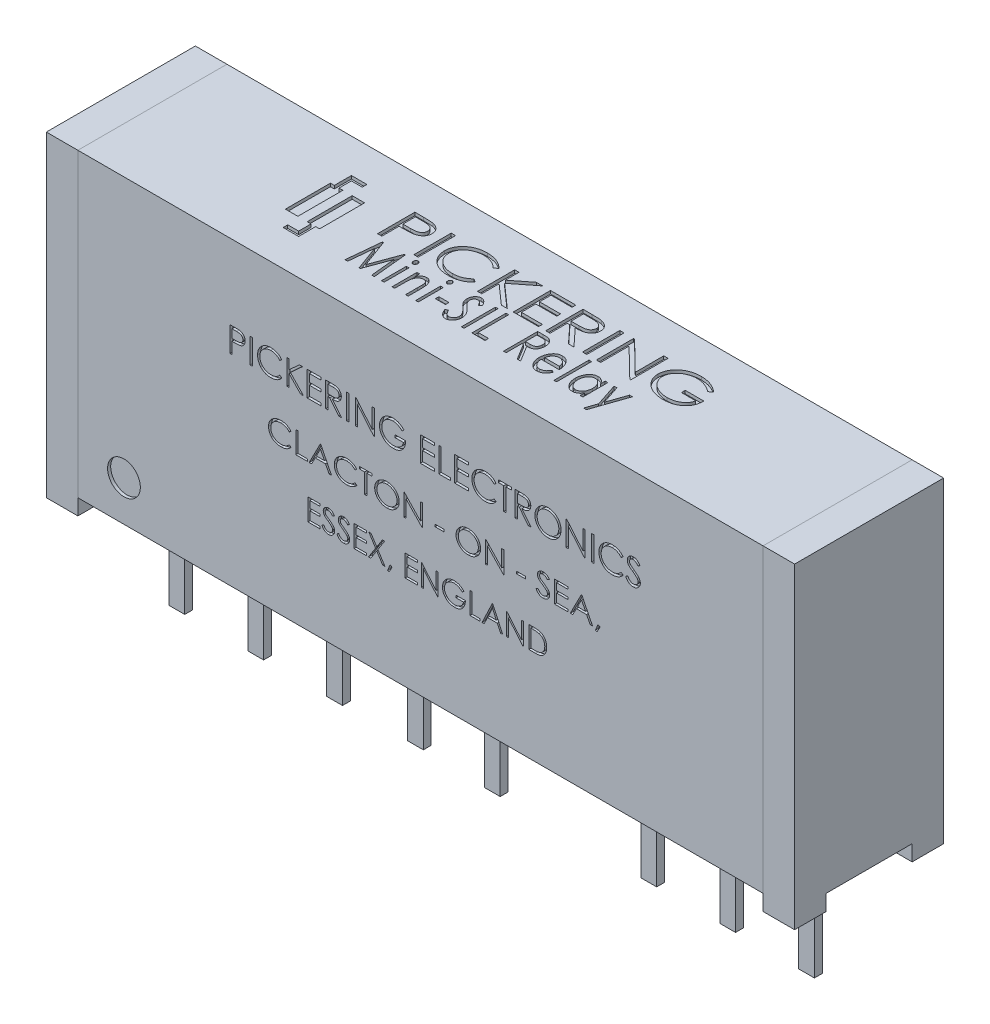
SolidWorks part; units mm, degrees
ref_plane "Front Plane" through (0, 0, 0) normal (0, 0, 1) x (1, 0, 0)
ref_plane "Top Plane" through (0, 0, 0) normal (0, 1, 0) x (1, 0, 0)
ref_plane "Right Plane" through (0, 0, 0) normal (1, 0, 0) x (0, 0, -1)
sketch "Sketch1" plane through (0, 0, 0) normal (0, 1, 0) x (1, 0, 0)
  line L1 (11.034, -2.4) -> (-11.034, -2.4)
  line L2 (11.034, -2.4) -> (11.034, 2.4)
  line L3 (11.034, 2.4) -> (-11.034, 2.4)
  line L4 (-11.034, -2.4) -> (-11.034, 2.4)
  line L5 (11.034, -2.4) -> (-11.034, 2.4) construction
  line L6 (11.034, 2.4) -> (-11.034, -2.4) construction
  point P0 (0, 0)
  dimension "D1" = 4.8
  dimension "D2" = 22.068
extrude "main box" add sketch "Sketch1" along normal blind 9.692
sketch "Sketch2" plane through (-11.034, 0, 0) normal (-1, 0, 0) x (0, 0, 1)
  line L0 (-2.4, 9.692) -> (2.4, 9.692)
  line L1 (2.4, 9.692) -> (2.4, -0.508)
  line L2 (2.4, -0.508) -> (-2.4, -0.508)
  line L3 (-2.4, -0.508) -> (-2.4, 9.692)
  dimension "D1" = 10.2
extrude "end section plus feet" add sketch "Sketch2" along normal blind 1.016 separate body
sketch "Sketch4" plane through (0, 0, 0) normal (0, -1, 0) x (1, 0, 0)
  line L1 (-10.374, -0.127) -> (-9.866, -0.127)
  line L2 (-10.374, -0.127) -> (-10.374, 0.127)
  line L3 (-10.374, 0.127) -> (-9.866, 0.127)
  line L4 (-9.866, -0.127) -> (-9.866, 0.127)
  line L5 (-10.374, -0.127) -> (-9.866, 0.127) construction
  line L6 (-10.374, 0.127) -> (-9.866, -0.127) construction
  line L7 (-7.834, -0.127) -> (-7.326, -0.127)
  line L8 (-7.834, -0.127) -> (-7.834, 0.127)
  line L9 (-7.834, 0.127) -> (-7.326, 0.127)
  line L10 (-7.326, -0.127) -> (-7.326, 0.127)
  line L11 (-7.834, -0.127) -> (-7.326, 0.127) construction
  line L12 (-7.834, 0.127) -> (-7.326, -0.127) construction
  line L13 (-4.786, -0.127) -> (-5.294, -0.127)
  line L14 (-4.786, -0.127) -> (-4.786, 0.127)
  line L15 (-4.786, 0.127) -> (-5.294, 0.127)
  line L16 (-5.294, -0.127) -> (-5.294, 0.127)
  line L17 (-4.786, -0.127) -> (-5.294, 0.127) construction
  line L18 (-4.786, 0.127) -> (-5.294, -0.127) construction
  line L19 (-12.05, 2.4) -> (-12.05, -2.4) construction
  line L20 (0.294, -0.127) -> (-0.214, -0.127)
  line L21 (0.294, -0.127) -> (0.294, 0.127)
  line L22 (0.294, 0.127) -> (-0.214, 0.127)
  line L23 (-0.214, -0.127) -> (-0.214, 0.127)
  line L24 (0.294, -0.127) -> (-0.214, 0.127) construction
  line L25 (0.294, 0.127) -> (-0.214, -0.127) construction
  line L26 (7.874, -0.127) -> (7.366, -0.127)
  line L27 (7.874, -0.127) -> (7.874, 0.127)
  line L28 (7.874, 0.127) -> (7.366, 0.127)
  line L29 (7.366, -0.127) -> (7.366, 0.127)
  line L30 (7.874, -0.127) -> (7.366, 0.127) construction
  line L31 (7.874, 0.127) -> (7.366, -0.127) construction
  line L32 (5.334, -0.127) -> (4.826, -0.127)
  line L33 (5.334, -0.127) -> (5.334, 0.127)
  line L34 (5.334, 0.127) -> (4.826, 0.127)
  line L35 (4.826, -0.127) -> (4.826, 0.127)
  line L36 (5.334, -0.127) -> (4.826, 0.127) construction
  line L37 (5.334, 0.127) -> (4.826, -0.127) construction
  line L38 (-2.2469, -0.193) -> (-2.7549, -0.193)
  line L39 (-2.2469, -0.193) -> (-2.2469, 0.061)
  line L40 (-2.2469, 0.061) -> (-2.7549, 0.061)
  line L41 (-2.7549, -0.193) -> (-2.7549, 0.061)
  line L42 (-2.2469, -0.193) -> (-2.7549, 0.061) construction
  line L43 (-2.2469, 0.061) -> (-2.7549, -0.193) construction
  line L44 (10.414, -0.127) -> (9.906, -0.127)
  line L45 (10.414, -0.127) -> (10.414, 0.127)
  line L46 (10.414, 0.127) -> (9.906, 0.127)
  line L47 (9.906, -0.127) -> (9.906, 0.127)
  line L48 (10.414, -0.127) -> (9.906, 0.127) construction
  line L49 (10.414, 0.127) -> (9.906, -0.127) construction
  point P0 (-10.12, 0)
  point P5 (-7.58, 0)
  point P11 (-5.04, 0)
  point P18 (0.04, 0)
  point P23 (7.62, 0)
  point P28 (5.08, 0)
  point P33 (-2.5009, -0.066)
  point P38 (10.16, 0)
  dimension "D1" = 0.254
  dimension "D2" = 0.508
  dimension "D3" = 5.08
  dimension "D4" = 0.508
  dimension "D5" = 0.254
  dimension "D6" = 0.508
  dimension "D7" = 1.93
  dimension "D8" = 0.254
  dimension "D9" = 2.54
  dimension "D10" = 5.08
  dimension "D11" = 0.254
  dimension "D12" = 0.508
  dimension "D13" = 0.254
  dimension "D14" = 0.508
  dimension "D15" = 0.508
  dimension "D16" = 0.508
  dimension "D17" = 0.254
  dimension "D18" = 2.54
  dimension "D19" = 0.508
  dimension "D20" = 0.254
  dimension "D21" = 1.0765
  dimension "D22" = 2.54
  dimension "D23" = 0.254
  dimension "D24" = 2.54
extrude "Pins" add sketch "Sketch4" along normal blind 3.808
sketch "Sketch6"
  dimension "D1" = 10.15
  dimension "D2" = 9.25
  dimension "D3" = 8
  dimension "D4" = 8.3
  dimension "D5" = 2.3
  dimension "D6" = 1.25
extrude "Top writing" cut sketch "Sketch6" against normal blind 0.1
sketch "Sketch7"
  dimension "D1" = 14
  dimension "D2" = 5.5
extrude "Pickering electronics" cut sketch "Sketch7" against normal blind 0.1
sketch "Sketch8"
  dimension "D4" = 2.5
  dimension "D1" = 11
  dimension "D2" = 7
  dimension "D3" = 6.5
extrude "Address" cut sketch "Sketch8" against normal blind 0.1
sketch "Sketch9" plane through (0, 9.692, 0) normal (0, 1, 0) x (1, 0, 0)
  line L0 (11.034, 2.4) -> (-11.034, 2.4) construction
  line L1 (-5.35, 0.75) -> (-4.95, 0.75)
  line L2 (-5.35, 0.75) -> (-5.35, -0.7)
  line L3 (-5.35, -0.7) -> (-5.225, -0.7)
  line L4 (-4.95, 0.75) -> (-4.95, -0.7)
  line L5 (-12.05, -2.4) -> (-12.05, 2.4) construction
  line L6 (-5.65, 0.75) -> (-5.775, 0.75)
  line L7 (-5.65, 0.75) -> (-5.65, -0.7)
  line L8 (-5.65, -0.7) -> (-6.05, -0.7)
  line L9 (-6.05, 0.75) -> (-6.05, -0.7)
  line L10 (-5.925, 0.75) -> (-6.05, 0.75)
  line L11 (-5.075, -0.7) -> (-4.95, -0.7)
  line L12 (-5.925, 0.75) -> (-5.925, 1.3)
  line L13 (-5.925, 1.3) -> (-5.425, 1.3)
  line L14 (-5.775, 0.75) -> (-5.775, 1.15)
  line L15 (-5.425, 1.3) -> (-5.425, 1.15)
  line L16 (-5.075, -1.25) -> (-5.575, -1.25)
  line L17 (-5.425, 1.15) -> (-5.775, 1.15)
  line L20 (-5.075, -0.7) -> (-5.075, -1.25)
  line L22 (-5.225, -0.7) -> (-5.225, -1.1)
  line L25 (-5.225, -1.1) -> (-5.575, -1.1)
  line L26 (-5.575, -1.25) -> (-5.575, -1.1)
  dimension "D1" = 1.65
  dimension "D2" = 1.45
  dimension "D3" = 0.4
  dimension "D4" = 0.4
  dimension "D5" = 0.3
  dimension "D6" = 6
  dimension "D7" = 0.5
  dimension "D8" = 0.4
  dimension "D9" = 0.15
  dimension "D10" = 0.15
  dimension "D11" = 0.15
  dimension "D12" = 0.15
  dimension "D14" = 0.5
  dimension "D15" = 0.125
  dimension "D16" = 0.125
extrude "Pickering logo" cut sketch "Sketch9" against normal blind 0.1
sketch "Sketch10"
  dimension "D1" = 3.4
  dimension "D2" = 6
  dimension "D3" = 11.5
extrude "Relay type" add sketch "Sketch10" along normal blind 0.0001
sketch "Sketch11" plane through (11.034, 0, 0) normal (1, 0, 0) x (0, 0, -1)
  line L1 (-2.4, 9.692) -> (2.4, 9.692)
  line L2 (-2.4, 9.692) -> (-2.4, -0.508)
  line L3 (-2.4, -0.508) -> (2.4, -0.508)
  line L4 (2.4, 9.692) -> (2.4, -0.508)
extrude "Extrude8" add sketch "Sketch11" along normal blind 1.016 separate body
sketch "Sketch12" plane through (-12.05, 0, 0) normal (-1, 0, 0) x (0, 0, 1)
  line L0 (-2.4, -0.508) -> (2.4, -0.508) construction
  line L1 (-1.384, -0.508) -> (1.384, -0.508)
  line L2 (-1.384, -0.508) -> (-1.384, 0)
  line L3 (-1.384, 0) -> (1.384, 0)
  line L4 (1.384, -0.508) -> (1.384, 0)
  line L5 (2.4, -0.508) -> (2.4, 9.692) construction
  dimension "D1" = 0.508
  dimension "D2" = 2.768
  dimension "D3" = 1.016
extrude "Extrude9" cut sketch "Sketch12" against normal blind 1.016
sketch "Sketch13" plane through (12.05, 0, 0) normal (1, 0, 0) x (0, 0, -1)
  line L0 (-2.4, -0.508) -> (2.4, -0.508) construction
  line L1 (-1.384, -0.508) -> (1.384, -0.508)
  line L2 (-1.384, -0.508) -> (-1.384, 0)
  line L3 (-1.384, 0) -> (1.384, 0)
  line L4 (1.384, -0.508) -> (1.384, 0)
  line L6 (2.4, -0.508) -> (2.4, 9.692) construction
  dimension "D1" = 0.508
  dimension "D2" = 2.768
  dimension "D3" = 1.016
extrude "Extrude10" cut sketch "Sketch13" against normal blind 1.016
